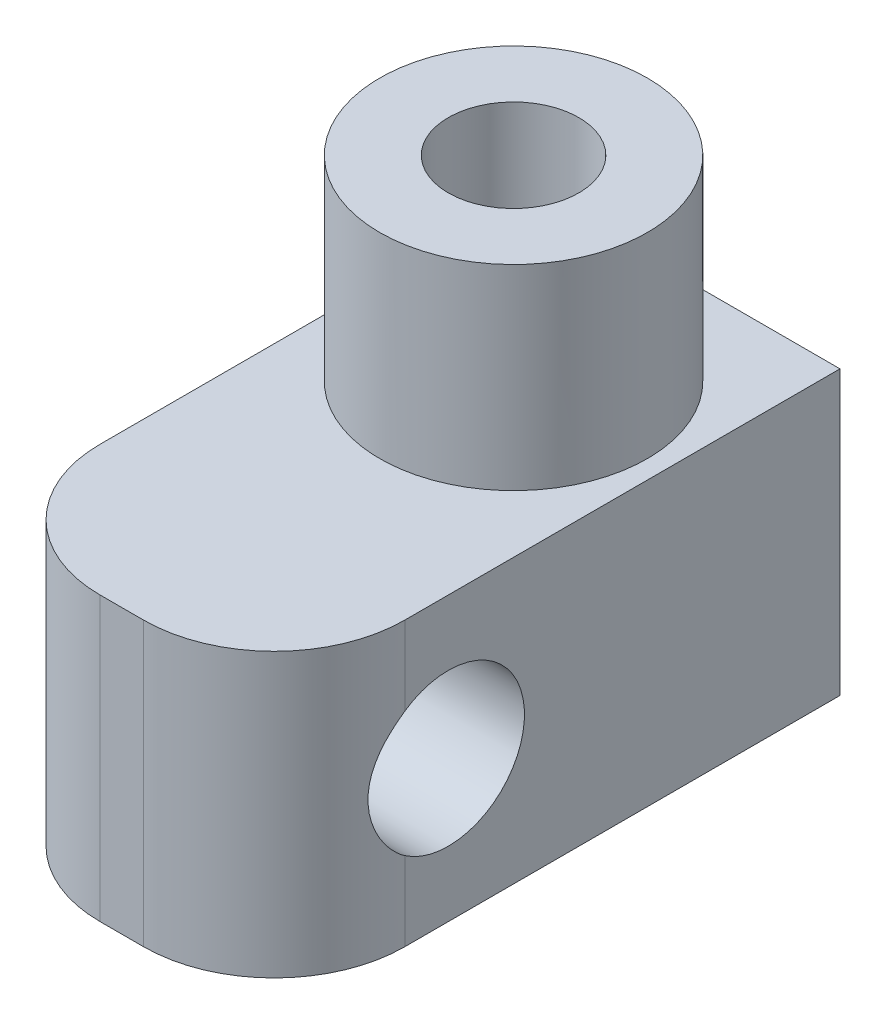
SolidWorks part; units mm, degrees
ref_plane "Front Plane" through (0, 0, 0) normal (0, 0, 1) x (1, 0, 0)
ref_plane "Top Plane" through (0, 0, 0) normal (0, 1, 0) x (1, 0, 0)
ref_plane "Right Plane" through (0, 0, 0) normal (1, 0, 0) x (0, 0, -1)
sketch "Sketch1" plane through (0, 0, 0) normal (0, 1, 0) x (1, 0, 0)
  circle A0 centre (0, 0) radius 3.075
  dimension "D1" = 6.15
extrude "Boss-Extrude1" add sketch "Sketch1" along normal blind 11
sketch "Sketch2" plane through (0, 0, 0) normal (0, -1, 0) x (1, 0, 0)
  line L0 (0, 0) -> (0, -4) construction
  line L1 (3.5, -4) -> (-3.5, -4) construction
  line L2 (0, -4) -> (0, 9) construction
  line L3 (0.5, 9) -> (-0.5, 9) construction
  line L4 (-3.5, 6) -> (-3.5, -4) construction
  line L5 (3.5, 6) -> (3.5, -4) construction
  line L6 (3.5, -4) -> (3.5, 6)
  line L8 (0.5, 9) -> (0, 9)
  line L9 (0, 9) -> (-0.5, 9)
  line L11 (-3.5, 6) -> (-3.5, -4)
  line L12 (-3.5, -4) -> (3.5, -4)
  arc A0 (0.5, 9) -> (3.5, 6) centre (0.5, 6) cw construction
  arc A1 (-0.5, 9) -> (-3.5, 6) centre (-0.5, 6) ccw construction
  arc A2 (-3.5, 6) -> (-0.5, 9) centre (-0.5, 6) cw
  arc A3 (3.5, 6) -> (0.5, 9) centre (0.5, 6) ccw
  point P10 (3.5, 9)
  point P13 (-3.5, 9)
  dimension "D4" = 3
  dimension "D1" = 4
  dimension "D2" = 3.5
  dimension "D3" = 13
extrude "Boss-Extrude2" add sketch "Sketch2" against normal blind 6.5
sketch "Sketch3" plane through (0, 11, 0) normal (0, 1, 0) x (1, 0, 0)
  circle A0 centre (0, 0) radius 1.5
  dimension "D1" = 3
extrude "Cut-Extrude1" cut sketch "Sketch3" against normal through all contours A0
sketch "Sketch4" plane through (0, 0, 0) normal (0, -1, 0) x (1, 0, 0)
  circle A0 centre (0, 0) radius 3
  dimension "D1" = 6
extrude "Cut-Extrude2" cut sketch "Sketch4" against normal blind 2 contours A0
sketch "Sketch5" plane through (-3.5, 0, 0) normal (-1, 0, 0) x (0, 0, 1)
  line L0 (9, 6.5) -> (9, 0) construction
  line L1 (9, 3.25) -> (5, 3.25) construction
  circle A0 centre (5, 3.25) radius 1.75
  dimension "D2" = 3.5
  dimension "D1" = 4
extrude "Cut-Extrude3" cut sketch "Sketch5" against normal through all
